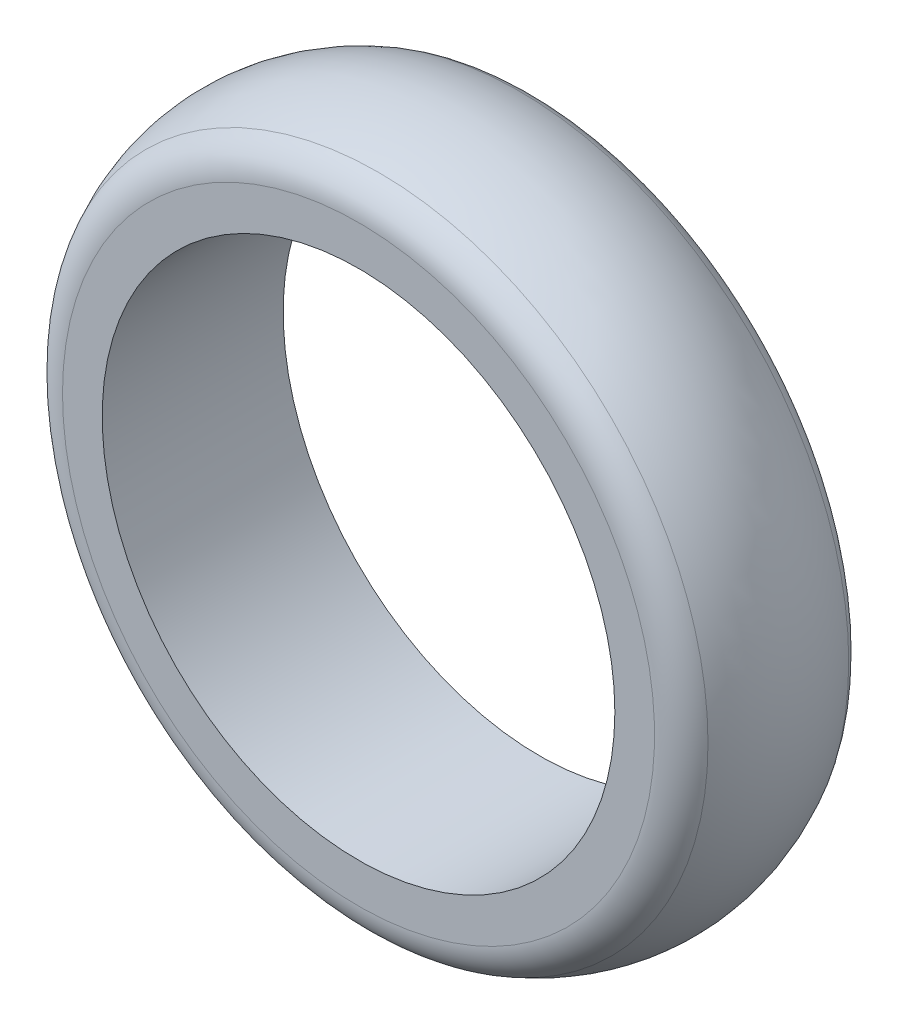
SolidWorks part; units mm, degrees
ref_plane "Alzado" through (0, 0, 0) normal (0, 0, 1) x (1, 0, 0)
ref_plane "Planta" through (0, 0, 0) normal (0, 1, 0) x (1, 0, 0)
ref_plane "Vista lateral" through (0, 0, 0) normal (1, 0, 0) x (0, 0, -1)
sketch "Croquis1" plane through (0, 0, 0) normal (1, 0, 0) x (0, 0, -1)
  line L0 (0, 0) -> (0, 34) construction
  line L1 (0, 34) -> (24, 34)
  line L2 (0, 34) -> (0, 42)
  line L4 (24, 34) -> (24, 42)
  line L5 (12, 26) -> (12, 34) construction
  line L6 (0, 0) -> (24, 0) construction
  line L7 (24, 0) -> (24, 34) construction
  arc A0 (0, 42) -> (24, 42) centre (12, 26) cw
  point P7 (12, 46)
  dimension "D1" = 24
  dimension "D2" = 8
  dimension "D3" = 34
  dimension "D4" = 4
revolve "Revolución1" add sketch "Croquis1" angle 360 about L6
fillet "Redondeo1" radius 5 2 edges at (42, 0, -24) (42, 0, 0)
